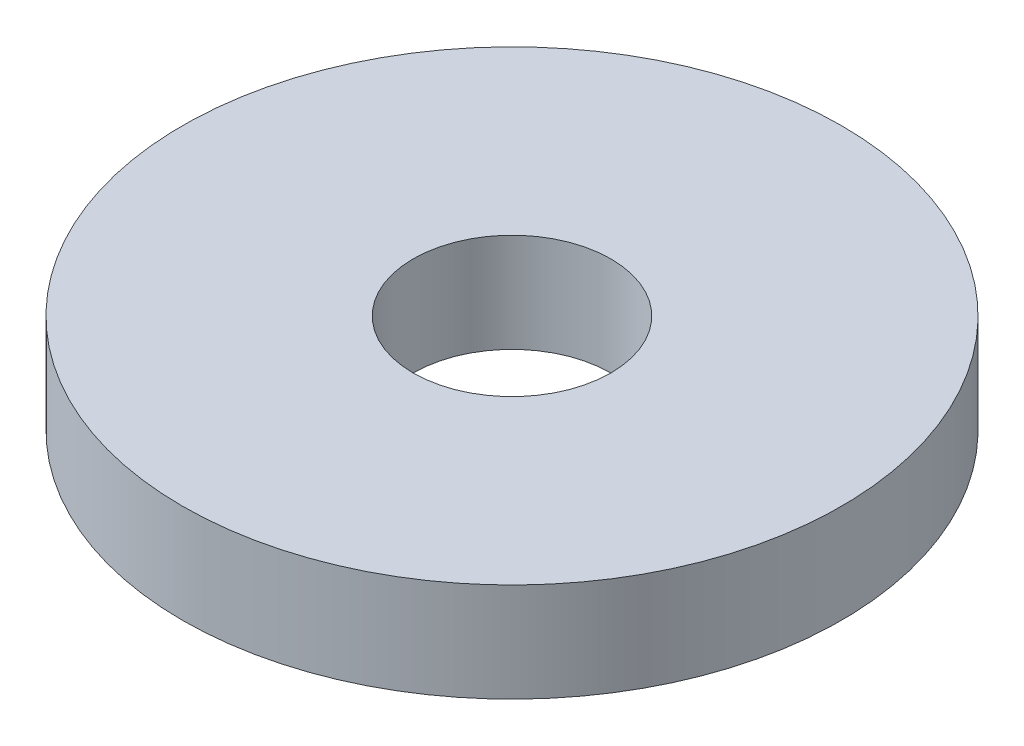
SolidWorks part; units mm, degrees
ref_plane "前视基准面" through (0, 0, 0) normal (0, 0, 1) x (1, 0, 0)
ref_plane "上视基准面" through (0, 0, 0) normal (0, 1, 0) x (1, 0, 0)
ref_plane "右视基准面" through (0, 0, 0) normal (1, 0, 0) x (0, 0, -1)
other "Configuration Table"
sketch "FlangeSketch" plane through (0, 0, 0) normal (0, 1, 0) x (1, 0, 0)
  circle A0 centre (0, 0) radius 50
extrude "FlangeBoss" add sketch "FlangeSketch" against normal blind 15
sketch "CenterHoleSketch" plane through (0, 0, 0) normal (0, 1, 0) x (1, 0, 0)
  circle A0 centre (0, 0) radius 15
extrude "CenterHoleCut" cut sketch "CenterHoleSketch" against normal blind 15
